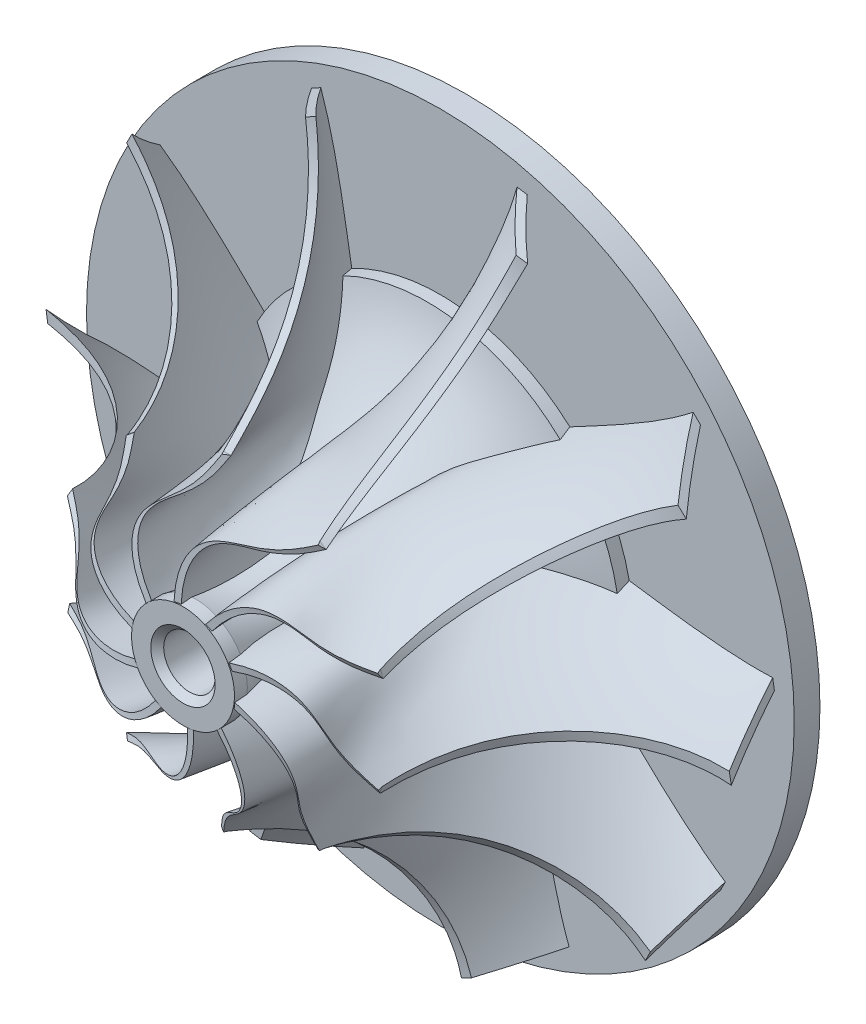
SolidWorks part; units mm, degrees
ref_plane "Front Plane" through (0, 0, 0) normal (0, 0, 1) x (1, 0, 0)
ref_plane "Top Plane" through (0, 0, 0) normal (0, 1, 0) x (1, 0, 0)
ref_plane "Right Plane" through (0, 0, 0) normal (1, 0, 0) x (0, 0, -1)
sketch "Sketch1" plane through (0, 0, 0) normal (0, 0, 1) x (1, 0, 0)
  circle A0 centre (0, 0) radius 27.5
  dimension "D1" = 55
extrude "Boss-Extrude1" add sketch "Sketch1" along normal blind 2
sketch "Sketch2" plane through (0, 0, 0) normal (0, 1, 0) x (1, 0, 0)
  line L0 (15, -2) -> (0, -2)
  line L1 (-27.5, -2) -> (27.5, -2) construction
  line L2 (0, -2) -> (0, -22)
  line L3 (0, -22) -> (4, -22)
  line L4 (4, -22) -> (4, -21)
  line L5 (15, -2) -> (15, -3)
  arc A0 (4, -21) -> (15, -3) centre (18.6006, -17.5615) cw
  dimension "D5" = 15
  dimension "D1" = 20
  dimension "D2" = 15
  dimension "D3" = 1
  dimension "D4" = 1
  dimension "D6" = 4
revolve "Revolve1" add sketch "Sketch2" angle 360 about L2
sketch "Sketch3" plane through (0, 0, 0) normal (0, 1, 0) x (1, 0, 0)
  line L0 (-15, -2) -> (15, -2) construction
  line L1 (-4, -22) -> (4, -22) construction
  line L2 (3.6729, -2) -> (4.3275, -2)
  line L3 (-0.3, -22) -> (0.3, -22)
  arc A0 (4, -2) -> (0, -22) centre (47.9933, -21.1987) ccw construction
  arc A1 (3.6729, -2) -> (-0.3, -22) centre (47.9933, -21.1987) ccw
  arc A2 (4.3275, -2) -> (0.3, -22) centre (47.9933, -21.1987) ccw
  arc A3 (4.275, -2.12) -> (0.3, -21.995) centre (47.9933, -21.1987) ccw construction
  arc A4 (3.725, -1.88) -> (-0.3, -22.005) centre (47.9933, -21.1987) ccw construction
  dimension "D1" = 48
  dimension "D2" = 4
  dimension "D3" = 0.3
  dimension "D4" = 0.3
sketch "Sketch4" plane through (0, 0, 2) normal (0, 0, 1) x (1, 0, 0)
  line L0 (0, 5.6832) -> (0, -6.1957) construction
  spline S0 degree 3 poles (0, 0) (0, 8.3665) (4.08, 12.226) (13.5211, 16.9788) (16.5, 20) knots 0 0 0 0 0.505882 1 1 1 1
  dimension "D1" = 12.5
  dimension "D2" = 5.5
  dimension "D3" = 17
  dimension "D4" = 20
  dimension "D5" = 12.8
  dimension "D6" = 16.5
sweep "Sweep1" add profiles "Sketch3" path "Sketch4" parameters "D1"=60
sketch "Sketch5" plane through (0, 0, 0) normal (0, 1, 0) x (1, 0, 0)
  line L0 (27.5, -2) -> (27.5, -6)
  line L1 (0, 0) -> (30.3378, 0)
  line L2 (0, 0) -> (0, 6.8581)
  line L3 (0, 6.8581) -> (30.3378, 6.8581)
  line L4 (30.3378, 0) -> (30.3378, 6.8581)
  line L5 (-27.5, -2) -> (27.5, -2) construction
  line L6 (12.6851, -18.6505) -> (12.6851, -22)
  line L7 (12.6851, -22) -> (35, -22)
  line L8 (35, -22) -> (35, -2)
  line L9 (35, -2) -> (27.5, -2)
  line L10 (27.5, -2) -> (27.5, 0) construction
  arc A0 (27.5, -6) -> (12.6851, -18.6505) centre (27.5, -21) ccw
  spline S0 degree 3 poles (1.6966, -21.9441) (2.0186, -21.9232) (2.3486, -21.8966) (3.762, -21.761) (4.8901, -21.5994) (6.3207, -21.2719) (6.7519, -21.1485) (7.5314, -20.874) (7.8812, -20.7229) (8.9406, -20.2287) (9.6911, -19.8449) (12.8997, -18.561) (15.5572, -17.5165) (20.0901, -15.7088) (21.6953, -15.0662) (25.0846, -13.712) (26.8745, -13.0002) (28.7267, -12.2598) knots 0.087153 0.087153 0.087153 0.087153 0.12647 0.12647 0.25294 0.25294 0.316176 0.316176 0.379411 0.379411 0.505881 0.505881 0.75294 0.75294 0.87647 0.87647 1 1 1 1 construction
  dimension "D2" = 15
  dimension "D1" = 4
  dimension "D3" = 35
  dimension "D4" = 20
revolve "Cut-Revolve1" cut sketch "Sketch5" angle 360 about L2
pattern_circular "CirPattern1" count 10 over 360 about axis through (0, 0, 2) along (0, 0, -1) of "Cut-Revolve1", "Sweep1"
sketch "Sketch6" plane through (0, 0, 0) normal (0, 1, 0) x (1, 0, 0)
  line L0 (0, 0) -> (0, -27.2236)
  line L1 (0, -27.2236) -> (2, -27.2236)
  line L2 (2, -27.2236) -> (2, -12)
  line L3 (2, -12) -> (4, -12)
  line L4 (4, -12) -> (4, 0)
  line L5 (27.5, 0) -> (-27.5, 0) construction
  line L6 (4, 0) -> (0, 0)
  dimension "D1" = 12
  dimension "D2" = 2
  dimension "D3" = 4
revolve "Cut-Revolve2" cut sketch "Sketch6" angle 360 about L0
chamfer "Chamfer1" distance 0.5 angle 45 1 edges at (-2, 0, 22)
sketch "Sketch7" plane through (0, 0, 0) normal (0, 0, -1) x (-1, 0, 0)
  line L0 (-2.6458, 3) -> (2.6458, 3)
  line L1 (0, 0) -> (7.5307, 0) construction
  line L2 (-2.6458, -3) -> (2.6458, -3)
  circle A0 centre (0, 0) radius 4 construction
  arc A1 (-2.6458, -3) -> (2.6458, -3) centre (0, 0) ccw
  arc A2 (2.6458, 3) -> (-2.6458, 3) centre (0, 0) ccw
  dimension "D1" = 3
extrude "Boss-Extrude2" add sketch "Sketch7" against normal up to surface (12 mm away)
